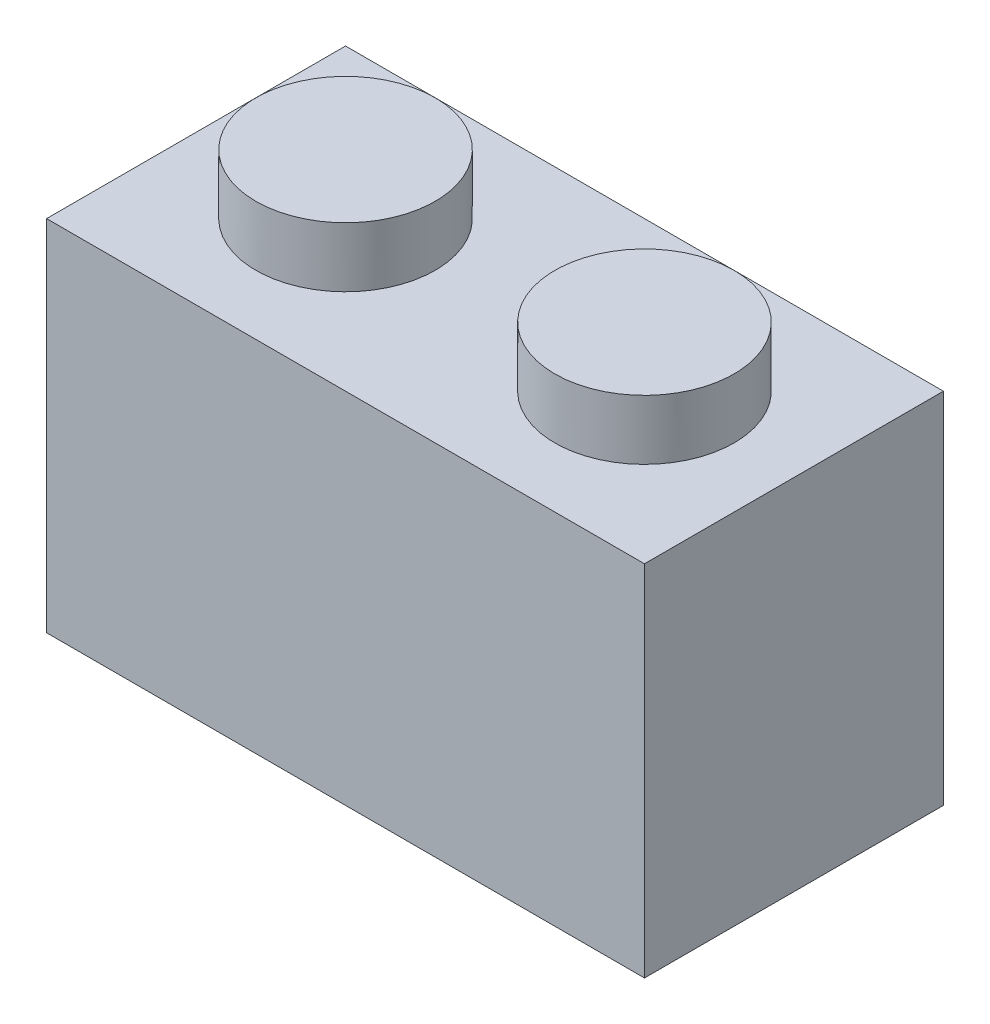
SolidWorks part; units mm, degrees
ref_plane "Front Plane" through (0, 0, 0) normal (0, 0, 1) x (1, 0, 0)
ref_plane "Top Plane" through (0, 0, 0) normal (0, 1, 0) x (1, 0, 0)
ref_plane "Right Plane" through (0, 0, 0) normal (1, 0, 0) x (0, 0, -1)
sketch "Sketch1" plane through (0, 0, 0) normal (0, 1, 0) x (1, 0, 0)
  line L1 (-8, -4) -> (8, -4)
  line L2 (-8, -4) -> (-8, 4)
  line L3 (-8, 4) -> (8, 4)
  line L4 (8, -4) -> (8, 4)
  line L5 (-8, -4) -> (8, 4) construction
  line L6 (-8, 4) -> (8, -4) construction
  point P0 (0, 0)
  dimension "D1" = 16
  dimension "D2" = 8
extrude "Boss-Extrude1" add sketch "Sketch1" along normal blind 9.6
sketch "Sketch2" plane through (0, 9.6, 0) normal (0, 1, 0) x (1, 0, 0)
  line L0 (-8, 4) -> (-8, -4) construction
  line L1 (8, -4) -> (8, 4) construction
  circle A0 centre (-4, 0) radius 2.4
  circle A1 centre (4, 0) radius 2.4
  dimension "D1" = 4
  dimension "D2" = 4
extrude "Boss-Extrude2" add sketch "Sketch2" along normal blind 1.6
shell "Shell1" thickness 1.6
sketch "Sketch3" plane through (0, 0, 0) normal (0, -1, 0) x (1, 0, 0)
  line L0 (-0.4, 2.4) -> (-0.4, 1.5492)
  line L1 (-0.4, -2.4) -> (0.4, -2.4)
  line L2 (0.4, -2.4) -> (0.4, -1.5492)
  line L3 (0.4, 2.4) -> (-0.4, 2.4)
  line L4 (-6.4, 2.4) -> (6.4, 2.4) construction
  line L5 (6.4, -2.4) -> (-6.4, -2.4) construction
  line L6 (-0.4, -1.5492) -> (-0.4, -2.4)
  line L7 (0.4, 1.5492) -> (0.4, 2.4)
  arc A0 (-0.4, 1.5492) -> (-0.4, -1.5492) centre (0, 0) ccw
  arc A1 (0.4, -1.5492) -> (0.4, 1.5492) centre (0, 0) ccw
  dimension "D1" = 0.4
  dimension "D2" = 0.8
  dimension "D3" = 0
  dimension "D4" = 0
extrude "Boss-Extrude3" add sketch "Sketch3" against normal up to surface (8 mm away)
